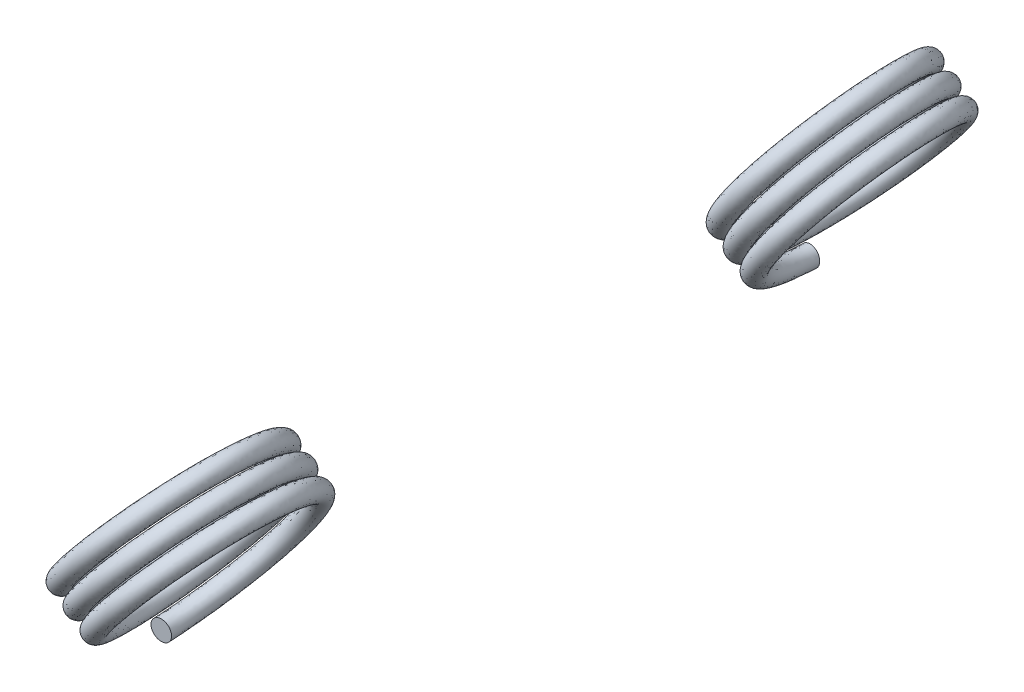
SolidWorks part; units mm, degrees
ref_plane "Alzado" through (0, 0, 0) normal (0, 0, 1) x (1, 0, 0)
ref_plane "Planta" through (0, 0, 0) normal (0, 1, 0) x (1, 0, 0)
ref_plane "Vista lateral" through (0, 0, 0) normal (1, 0, 0) x (0, 0, -1)
sketch3d "Sk_Plano_muelle_izq"
  point P0 (-234.166, 351.0365, 0)
  point P1 (-234.166, 351.0365, 10)
  point P2 (-228.1748, 359.0431, 0)
ref_plane "Plano_muelle_izq" through (-318.5014, 238.3334, 0) normal (-0.8007, 0.5991, 0) x (0, 0, 1)
sketch "Sk_muelle_izq" plane through (-318.5014, 238.3334, 0) normal (-0.8007, 0.5991, 0) x (0, 0, 1)
  circle A0 centre (-26, 140.7638) radius 7.5
  dimension "DIAM1" = 15
curve "Helice_izq"
sweep "Muelle_izq" add path "Helice_izq" parameters "D3"=1.6
sketch3d "Sk_Plano_muelle_dcho"
  point P0 (-234.166, 351.0365, 0)
  point P1 (-234.166, 351.0365, 10)
  point P2 (-228.1748, 359.0431, 0)
ref_plane "Plano_muelle_dcho" through (-318.5014, 238.3334, 0) normal (-0.8007, 0.5991, 0) x (0, 0, 1)
sketch "Sk_muelle_dcho" plane through (-318.5014, 238.3334, 0) normal (-0.8007, 0.5991, 0) x (0, 0, 1)
  circle A0 centre (26, 140.7638) radius 7.5
  dimension "DIAM2" = 15
curve "Helice_dcho"
sweep "Muelle_dcho" add path "Helice_dcho" parameters "D3"=1.6
